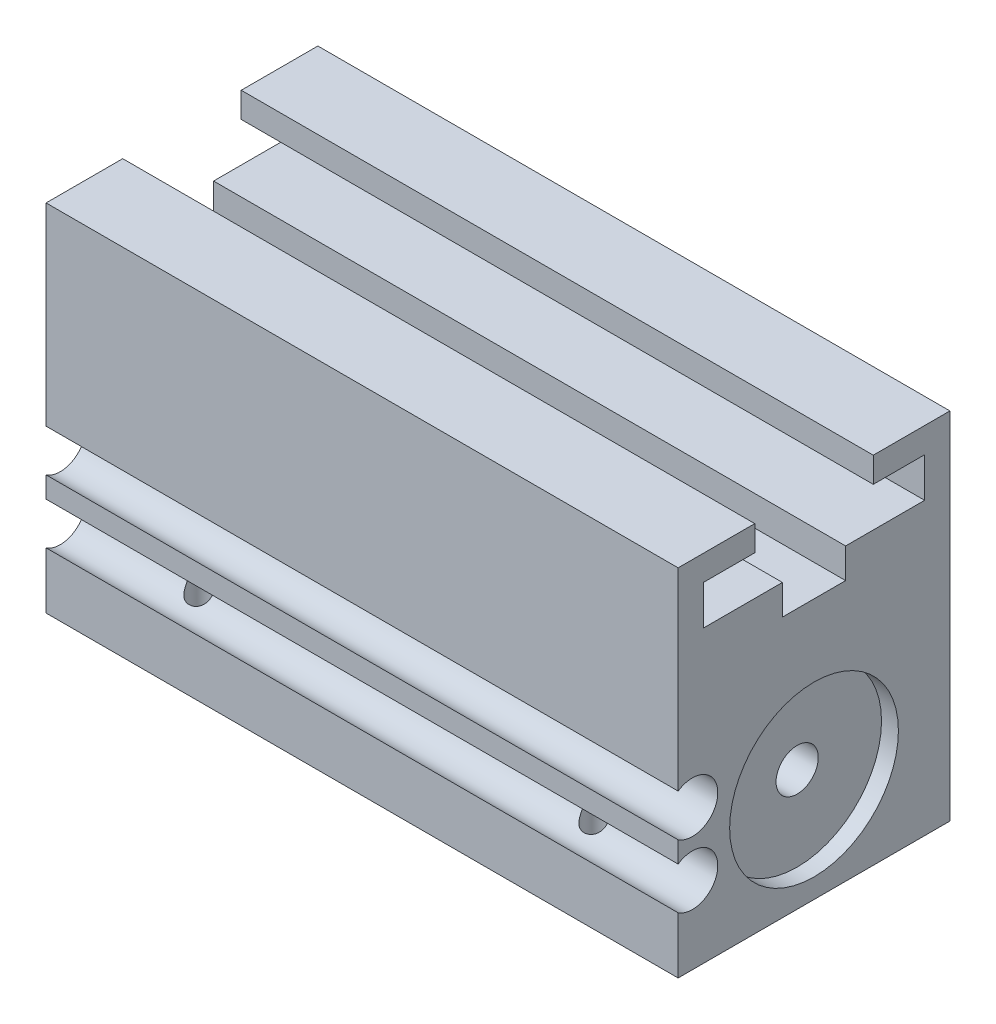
SolidWorks part; units mm, degrees
ref_plane "Front Plane" through (0, 0, 0) normal (0, 0, 1) x (1, 0, 0)
ref_plane "Top Plane" through (0, 0, 0) normal (0, 1, 0) x (1, 0, 0)
ref_plane "Right Plane" through (0, 0, 0) normal (1, 0, 0) x (0, 0, -1)
sketch "Sketch1" plane through (0, 0, 0) normal (1, 0, 0) x (0, 0, -1)
  line L0 (-10.922, -14.2748) -> (10.922, -14.2748)
  line L1 (10.922, -14.2748) -> (10.922, 14.2748)
  line L2 (10.922, 14.2748) -> (4.7625, 14.2748)
  line L3 (4.7625, 14.2748) -> (4.7625, 12.2428)
  line L4 (4.7625, 12.2428) -> (8.89, 12.2428)
  line L5 (8.89, 12.2428) -> (8.89, 9.0678)
  line L6 (8.89, 9.0678) -> (2.54, 9.0678)
  line L7 (2.54, 9.0678) -> (2.54, 6.6548)
  line L8 (2.54, 6.6548) -> (-2.54, 6.6548)
  line L9 (-2.54, 6.6548) -> (-2.54, 9.0678)
  line L10 (-2.54, 9.0678) -> (-8.89, 9.0678)
  line L11 (-8.89, 9.0678) -> (-8.89, 12.2428)
  line L12 (-8.89, 12.2428) -> (-4.7625, 12.2428)
  line L13 (-4.7625, 12.2428) -> (-4.7625, 14.2748)
  line L14 (-4.7625, 14.2748) -> (-10.922, 14.2748)
  line L15 (-10.922, 14.2748) -> (-10.922, -1.265)
  line L16 (-10.922, -4.6558) -> (-10.922, -6.345)
  line L17 (-10.922, -9.7358) -> (-10.922, -14.2748)
  arc A0 (-10.922, -1.265) -> (-10.922, -4.6558) centre (-9.779, -2.9604) cw
  arc A1 (-10.922, -6.345) -> (-10.922, -9.7358) centre (-9.779, -8.0404) cw
extrude "Extrude1" add sketch "Sketch1" along normal blind 50.8
ref_plane "Plane1" through (50.8, 0, 0) normal (1, 0, 0) x (0, 0, -1)
sketch "Sketch2" plane through (50.8, 0, 0) normal (1, 0, 0) x (0, 0, -1)
  circle A0 centre (0, -5.9182) radius 6.7818
extrude "Cut-Extrude1" cut sketch "Sketch2" against normal blind 1.3564
sketch "Sketch3" plane through (0, 0, 0) normal (1, 0, 0) x (0, 0, -1)
  circle A0 centre (8.7249, 4.3942) radius 1.2027
extrude "Cut-Extrude2" cut sketch "Sketch3" along normal blind 3.048
sketch "Sketch4" plane through (0, 0, 0) normal (1, 0, 0) x (0, 0, -1)
  circle A0 centre (-8.7249, -11.4808) radius 1.2027
extrude "Cut-Extrude3" cut sketch "Sketch4" along normal blind 3.048
ref_plane "Plane2" through (0, 0, 8.7249) normal (0, 0, 1) x (1, 0, 0)
sketch "Sketch5" plane through (0, 0, 8.7249) normal (0, 0, 1) x (1, 0, 0)
  line L0 (0, 4.3942) -> (0, 5.7912)
  line L1 (0, 5.7912) -> (0.381, 5.4102)
  line L2 (0.381, 5.4102) -> (6.2714, 5.4102)
  line L3 (6.2714, 5.4102) -> (6.858, 4.3942)
  line L4 (6.858, 4.3942) -> (0, 4.3942)
  line L5 (6.858, 4.3942) -> (0, 4.3942) construction
revolve "Cut-Revolve1" cut sketch "Sketch5" angle 360 about L5
ref_plane "Plane3" through (0, 0, -8.7249) normal (0, 0, 1) x (1, 0, 0)
sketch "Sketch6" plane through (0, 0, -8.7249) normal (0, 0, 1) x (1, 0, 0)
  line L0 (0, -11.4808) -> (0, -10.0838)
  line L1 (0, -10.0838) -> (0.381, -10.4648)
  line L2 (0.381, -10.4648) -> (6.2714, -10.4648)
  line L3 (6.2714, -10.4648) -> (6.858, -11.4808)
  line L4 (6.858, -11.4808) -> (0, -11.4808)
  line L5 (6.858, -11.4808) -> (0, -11.4808) construction
revolve "Cut-Revolve2" cut sketch "Sketch6" angle 360 about L5
ref_plane "Plane4" through (7.62, 0, 0) normal (1, 0, 0) x (0, 0, -1)
sketch "Sketch7" plane through (7.62, 0, 0) normal (1, 0, 0) x (0, 0, -1)
  line L0 (6.35, 1.5748) -> (6.35, 3.5179)
  line L1 (6.35, 3.5179) -> (10.4521, 3.5179)
  line L2 (10.4521, 3.5179) -> (10.922, 3.9878)
  line L3 (10.922, 3.9878) -> (10.922, 1.5748)
  line L4 (10.922, 1.5748) -> (6.35, 1.5748)
  line L5 (10.922, 1.5748) -> (6.35, 1.5748) construction
revolve "Cut-Revolve3" cut sketch "Sketch7" angle 360 about L5
ref_plane "Plane5" through (43.434, 0, 0) normal (1, 0, 0) x (0, 0, -1)
sketch "Sketch8" plane through (43.434, 0, 0) normal (1, 0, 0) x (0, 0, -1)
  line L0 (6.35, 1.5748) -> (6.35, 3.5179)
  line L1 (6.35, 3.5179) -> (10.4521, 3.5179)
  line L2 (10.4521, 3.5179) -> (10.922, 3.9878)
  line L3 (10.922, 3.9878) -> (10.922, 1.5748)
  line L4 (10.922, 1.5748) -> (6.35, 1.5748)
  line L5 (10.922, 1.5748) -> (6.35, 1.5748) construction
revolve "Cut-Revolve4" cut sketch "Sketch8" angle 360 about L5
sketch "Sketch9" plane through (0, 0, 0) normal (1, 0, 0) x (0, 0, -1)
  circle A0 centre (0, -5.9182) radius 6.7818
extrude "Cut-Extrude4" cut sketch "Sketch9" along normal blind 1.3564
ref_plane "Plane6" through (9.525, 0, 0) normal (1, 0, 0) x (0, 0, -1)
sketch "Sketch10" plane through (9.525, 0, 0) normal (1, 0, 0) x (0, 0, -1)
  line L0 (-7.9375, -14.2748) -> (-9.3345, -14.2748)
  line L1 (-9.3345, -14.2748) -> (-8.9535, -13.8938)
  line L2 (-8.9535, -13.8938) -> (-8.9535, -8.9178)
  line L3 (-8.9535, -8.9178) -> (-7.9375, -8.3312)
  line L4 (-7.9375, -8.3312) -> (-7.9375, -14.2748)
  line L5 (-7.9375, -8.3312) -> (-7.9375, -14.2748) construction
revolve "Cut-Revolve5" cut sketch "Sketch10" angle 360 about L5
ref_plane "Plane7" through (0, -14.2748, 0) normal (0, 1, 0) x (-1, 0, 0)
ref_plane "Plane8" through (41.275, 0, 0) normal (1, 0, 0) x (0, 0, -1)
ref_plane "Plane9" through (41.275, 0, 0) normal (1, 0, 0) x (0, 0, -1)
ref_plane "Plane10" through (9.525, 0, 0) normal (1, 0, 0) x (0, 0, -1)
sketch "Sketch11" plane through (41.275, 0, 0) normal (1, 0, 0) x (0, 0, -1)
  line L0 (-7.9375, -14.2748) -> (-9.3345, -14.2748)
  line L1 (-9.3345, -14.2748) -> (-8.9535, -13.8938)
  line L2 (-8.9535, -13.8938) -> (-8.9535, -8.9178)
  line L3 (-8.9535, -8.9178) -> (-7.9375, -8.3312)
  line L4 (-7.9375, -8.3312) -> (-7.9375, -14.2748)
  line L5 (-7.9375, -8.3312) -> (-7.9375, -14.2748) construction
sketch "Sketch12" plane through (41.275, 0, 0) normal (1, 0, 0) x (0, 0, -1)
  line L0 (7.9375, -14.2748) -> (6.5405, -14.2748)
  line L1 (6.5405, -14.2748) -> (6.9215, -13.8938)
  line L2 (6.9215, -13.8938) -> (6.9215, -8.9178)
  line L3 (6.9215, -8.9178) -> (7.9375, -8.3312)
  line L4 (7.9375, -8.3312) -> (7.9375, -14.2748)
  line L5 (7.9375, -8.3312) -> (7.9375, -14.2748) construction
sketch "Sketch13" plane through (9.525, 0, 0) normal (1, 0, 0) x (0, 0, -1)
  line L0 (7.9375, -14.2748) -> (6.5405, -14.2748)
  line L1 (6.5405, -14.2748) -> (6.9215, -13.8938)
  line L2 (6.9215, -13.8938) -> (6.9215, -8.9178)
  line L3 (6.9215, -8.9178) -> (7.9375, -8.3312)
  line L4 (7.9375, -8.3312) -> (7.9375, -14.2748)
  line L5 (7.9375, -8.3312) -> (7.9375, -14.2748) construction
revolve "Cut-Revolve6" cut sketch "Sketch11" angle 360 about L5
revolve "Cut-Revolve7" cut sketch "Sketch12" angle 360 about L5
revolve "Cut-Revolve8" cut sketch "Sketch13" angle 360 about L5
sketch "Sketch14" plane through (0, -14.2748, 0) normal (0, 1, 0) x (-1, 0, 0)
  circle A0 centre (-15.875, 7.9375) radius 1.2027
extrude "Cut-Extrude5" cut sketch "Sketch14" along normal blind 3.175
sketch "Sketch15" plane through (0, -14.2748, 0) normal (0, 1, 0) x (-1, 0, 0)
  circle A0 centre (-34.925, -7.9375) radius 1.2027
extrude "Cut-Extrude6" cut sketch "Sketch15" along normal blind 3.175
sketch "Sketch16" plane through (0, 0, 0) normal (0, 0, 1) x (1, 0, 0)
  line L0 (0, 2.8067) -> (0, 4.8387)
  line L1 (0, 4.8387) -> (0.381, 4.4577)
  line L2 (0.381, 4.4577) -> (3.048, 4.4577)
  line L3 (3.048, 4.4577) -> (3.048, 2.8067)
  line L4 (3.048, 2.8067) -> (0, 2.8067)
  line L5 (3.048, 2.8067) -> (0, 2.8067) construction
revolve "Cut-Revolve9" cut sketch "Sketch16" angle 360 about L5
sketch "Sketch17" plane through (0, 0, 0) normal (0, 0, 1) x (1, 0, 0)
  line L0 (8.8036, -5.9182) -> (8.8036, -4.2227)
  line L1 (8.8036, -4.2227) -> (49.4436, -4.2227)
  line L2 (49.4436, -4.2227) -> (49.4436, -5.9182)
  line L3 (49.4436, -5.9182) -> (8.8036, -5.9182)
  line L4 (49.4436, -5.9182) -> (8.8036, -5.9182) construction
revolve "Cut-Revolve10" cut sketch "Sketch17" angle 360 about L4
ref_plane "Plane11" through (50.8254, 0, 0) normal (1, 0, 0) x (0, 0, -1)
ref_plane "Plane12" through (50.8, 0, 0) normal (1, 0, 0) x (0, 0, -1)
ref_plane "Plane13" through (50.8, 0, 0) normal (1, 0, 0) x (0, 0, -1)
ref_plane "Plane14" through (25.5016, 0, 0) normal (1, 0, 0) x (0, 0, -1)
